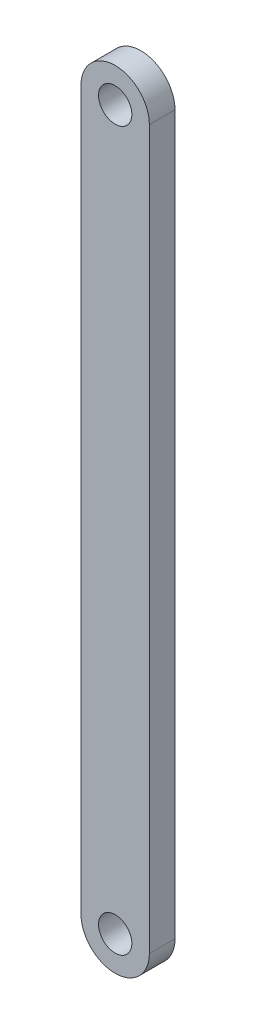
SolidWorks part; units mm, degrees
ref_plane "前视基准面" through (0, 0, 0) normal (0, 0, 1) x (1, 0, 0)
ref_plane "上视基准面" through (0, 0, 0) normal (0, 1, 0) x (1, 0, 0)
ref_plane "右视基准面" through (0, 0, 0) normal (1, 0, 0) x (0, 0, -1)
sketch "草图1" plane through (0, 0, 0) normal (0, 0, 1) x (1, 0, 0)
  line L0 (0, 0) -> (0, 84) construction
  line L1 (-4, 0) -> (-4, 84)
  line L2 (4, 0) -> (4, 84)
  arc A0 (-4, 0) -> (4, 0) centre (0, 0) ccw
  arc A1 (4, 84) -> (-4, 84) centre (0, 84) ccw
  point P3 (0, 42)
  dimension "D1" = 4
  dimension "D2" = 84
extrude "凸台-拉伸1" add sketch "草图1" along normal blind 3
hole_wizard "Ø3.9 (3.9) 直径孔1" positions "草图2" profile "草图3" hole size "Ø3.9" standard "GB"
sketch "草图2" plane through (0, 0, 3) normal (0, 0, 1) x (1, 0, 0)
  point P0 (0, 84)
  point P3 (0, 0)
sketch "草图3" plane through (0, 84, 3) normal (1, 0, 0) x (0, -1, 0)
  line L0 (0, 0) -> (0, 3)
  line L1 (0, 3) -> (1.95, 3)
  line L2 (1.95, 3) -> (1.95, 0)
  line L5 (1.95, 0) -> (0, 0)
  line L11 (0, -6.35) -> (0, 107.95) construction
  dimension "通孔孔直径" = 3.9
  dimension "通孔孔深度" = 3
